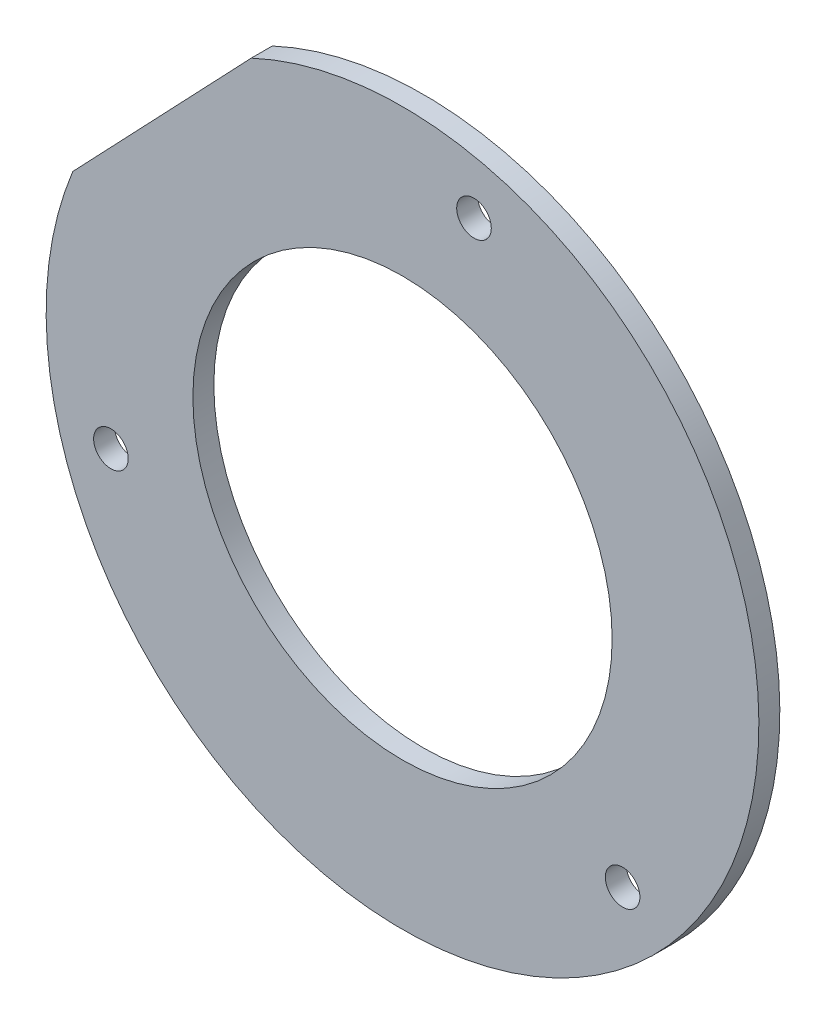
SolidWorks part; units mm, degrees
ref_plane "前视基准面" through (0, 0, 0) normal (0, 0, 1) x (1, 0, 0)
ref_plane "上视基准面" through (0, 0, 0) normal (0, 1, 0) x (1, 0, 0)
ref_plane "右视基准面" through (0, 0, 0) normal (1, 0, 0) x (0, 0, -1)
sketch "草图1" plane through (0, 0, 0) normal (0, 0, 1) x (1, 0, 0)
  line L0 (2.5699, 82.7859) -> (-14.4528, 64.9121)
  circle A0 centre (17, 52) radius 20
  arc A1 (-14.4528, 64.9121) -> (2.5699, 82.7859) centre (17, 52) ccw
  dimension "D1" = 40
extrude "拉伸1" add sketch "草图1" along normal blind 2
hole_wizard "M4 螺纹孔1" positions "草图3" profile "草图4" tap size "M4" standard "ISO"
sketch "草图3" plane through (0, 0, 2) normal (0, 0, 1) x (1, 0, 0)
  point P1 (23.8205, 80.1865)
  point P4 (-10.8205, 43.8135)
  point P7 (38, 32)
sketch "草图4" plane through (23.8205, 80.1865, 2) normal (1, 0, 0) x (0, -1, 0)
  line L0 (0, 0) -> (0, 2)
  line L1 (0, 2) -> (1.65, 2)
  line L2 (1.65, 2) -> (1.65, 0)
  line L5 (1.65, 0) -> (0, 0)
  line L11 (0, -6.35) -> (0, 107.95) construction
  dimension "籵謂蹟恇謂郰芛眻噤" = 3.3
  dimension "籵謂蹟恇謂郰芛旮僅" = 2
